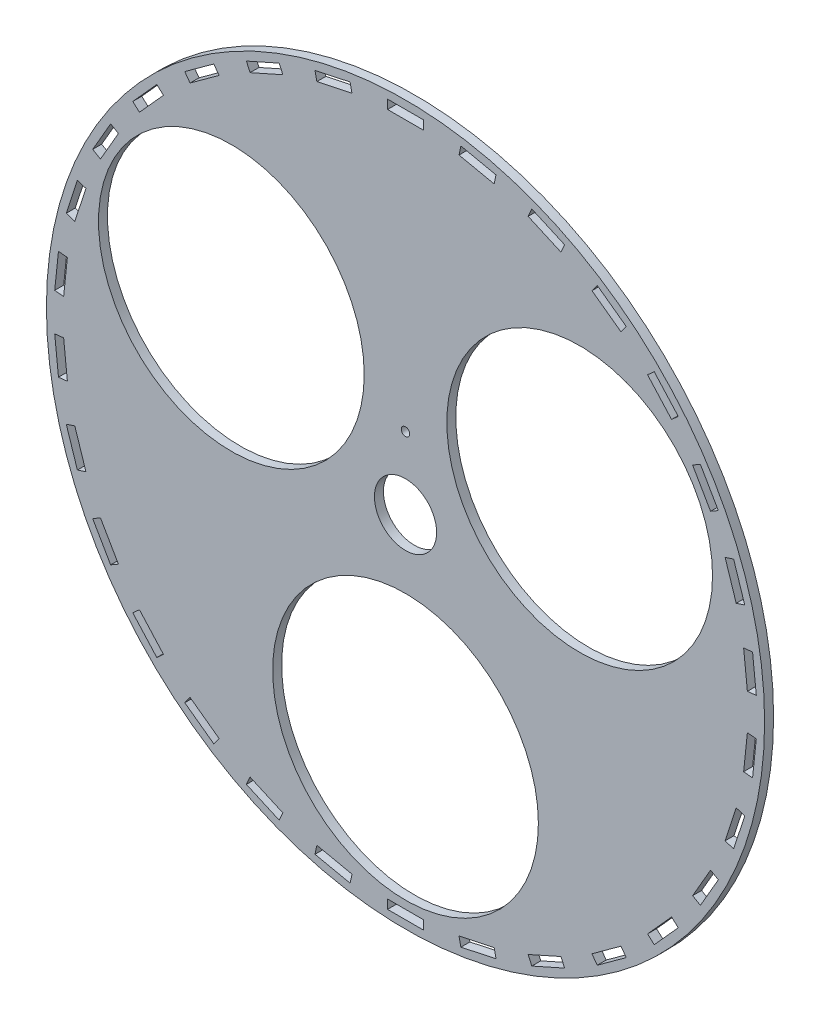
SolidWorks part; units mm, degrees
ref_plane "Front Plane" through (0, 0, 0) normal (0, 0, 1) x (1, 0, 0)
ref_plane "Top Plane" through (0, 0, 0) normal (0, 1, 0) x (1, 0, 0)
ref_plane "Right Plane" through (0, 0, 0) normal (1, 0, 0) x (0, 0, -1)
sketch "Sketch1" plane through (0, 0, 0) normal (0, 0, 1) x (1, 0, 0)
  line L0 (-31.3486, -116.9417) -> (-18.9261, -119.5822)
  line L1 (-6.35, -120.904) -> (6.35, -120.904)
  line L2 (-6.35, -120.904) -> (-6.35, -124.079)
  line L3 (-6.35, -124.079) -> (6.35, -124.079)
  line L4 (6.35, -120.904) -> (6.35, -124.079)
  line L5 (-31.3486, -116.9417) -> (-32.0087, -120.0473)
  line L6 (-32.0087, -120.0473) -> (-19.5862, -122.6878)
  line L7 (-18.9261, -119.5822) -> (-19.5862, -122.6878)
  line L8 (-54.9771, -107.8685) -> (-43.3751, -113.0341)
  line L9 (-54.9771, -107.8685) -> (-56.2685, -110.769)
  line L10 (-56.2685, -110.769) -> (-44.6665, -115.9346)
  line L11 (-43.3751, -113.0341) -> (-44.6665, -115.9346)
  line L12 (-76.2028, -94.081) -> (-65.9283, -101.5458)
  line L13 (-76.2028, -94.081) -> (-78.0691, -96.6496)
  line L14 (-78.0691, -96.6496) -> (-67.7945, -104.1145)
  line L15 (-65.9283, -101.5458) -> (-67.7945, -104.1145)
  line L16 (-94.0982, -76.1816) -> (-85.6002, -85.6195)
  line L17 (-94.0982, -76.1816) -> (-96.4576, -78.3061)
  line L18 (-96.4576, -78.3061) -> (-87.9597, -87.744)
  line L19 (-85.6002, -85.6195) -> (-87.9597, -87.744)
  line L20 (-107.8809, -54.9527) -> (-101.5309, -65.9513)
  line L21 (-107.8809, -54.9527) -> (-110.6306, -56.5402)
  line L22 (-110.6306, -56.5402) -> (-104.2806, -67.5388)
  line L23 (-101.5309, -65.9513) -> (-104.2806, -67.5388)
  line L24 (-116.9488, -31.3222) -> (-113.0243, -43.4006)
  line L25 (-116.9488, -31.3222) -> (-119.9684, -32.3033)
  line L26 (-119.9684, -32.3033) -> (-116.0439, -44.3817)
  line L27 (-113.0243, -43.4006) -> (-116.0439, -44.3817)
  line L28 (-120.9054, -6.3227) -> (-119.5779, -18.9531)
  line L29 (-120.9054, -6.3227) -> (-124.063, -6.6546)
  line L30 (-124.063, -6.6546) -> (-122.7355, -19.285)
  line L31 (-119.5779, -18.9531) -> (-122.7355, -19.285)
  line L32 (-119.5779, 18.9531) -> (-120.9054, 6.3227)
  line L33 (-119.5779, 18.9531) -> (-122.7355, 19.285)
  line L34 (-122.7355, 19.285) -> (-124.063, 6.6546)
  line L35 (-120.9054, 6.3227) -> (-124.063, 6.6546)
  line L36 (-113.0243, 43.4006) -> (-116.9488, 31.3222)
  line L37 (-113.0243, 43.4006) -> (-116.0439, 44.3817)
  line L38 (-116.0439, 44.3817) -> (-119.9684, 32.3033)
  line L39 (-116.9488, 31.3222) -> (-119.9684, 32.3033)
  line L40 (-101.5309, 65.9513) -> (-107.8809, 54.9527)
  line L41 (-101.5309, 65.9513) -> (-104.2806, 67.5388)
  line L42 (-104.2806, 67.5388) -> (-110.6306, 56.5402)
  line L43 (-107.8809, 54.9527) -> (-110.6306, 56.5402)
  line L44 (-85.6002, 85.6195) -> (-94.0982, 76.1816)
  line L45 (-85.6002, 85.6195) -> (-87.9597, 87.744)
  line L46 (-87.9597, 87.744) -> (-96.4576, 78.3061)
  line L47 (-94.0982, 76.1816) -> (-96.4576, 78.3061)
  line L48 (-65.9283, 101.5458) -> (-76.2028, 94.081)
  line L49 (-65.9283, 101.5458) -> (-67.7945, 104.1145)
  line L50 (-67.7945, 104.1145) -> (-78.0691, 96.6496)
  line L51 (-76.2028, 94.081) -> (-78.0691, 96.6496)
  line L52 (-43.3751, 113.0341) -> (-54.9771, 107.8685)
  line L53 (-43.3751, 113.0341) -> (-44.6665, 115.9346)
  line L54 (-44.6665, 115.9346) -> (-56.2685, 110.769)
  line L55 (-54.9771, 107.8685) -> (-56.2685, 110.769)
  line L56 (-18.9261, 119.5822) -> (-31.3486, 116.9417)
  line L57 (-18.9261, 119.5822) -> (-19.5862, 122.6878)
  line L58 (-19.5862, 122.6878) -> (-32.0087, 120.0473)
  line L59 (-31.3486, 116.9417) -> (-32.0087, 120.0473)
  line L60 (6.35, 120.904) -> (-6.35, 120.904)
  line L61 (6.35, 120.904) -> (6.35, 124.079)
  line L62 (6.35, 124.079) -> (-6.35, 124.079)
  line L63 (-6.35, 120.904) -> (-6.35, 124.079)
  line L64 (31.3486, 116.9417) -> (18.9261, 119.5822)
  line L65 (31.3486, 116.9417) -> (32.0087, 120.0473)
  line L66 (32.0087, 120.0473) -> (19.5862, 122.6878)
  line L67 (18.9261, 119.5822) -> (19.5862, 122.6878)
  line L68 (54.9771, 107.8685) -> (43.3751, 113.0341)
  line L69 (54.9771, 107.8685) -> (56.2685, 110.769)
  line L70 (56.2685, 110.769) -> (44.6665, 115.9346)
  line L71 (43.3751, 113.0341) -> (44.6665, 115.9346)
  line L72 (76.2028, 94.081) -> (65.9283, 101.5458)
  line L73 (76.2028, 94.081) -> (78.0691, 96.6496)
  line L74 (78.0691, 96.6496) -> (67.7945, 104.1145)
  line L75 (65.9283, 101.5458) -> (67.7945, 104.1145)
  line L76 (94.0982, 76.1816) -> (85.6002, 85.6195)
  line L77 (94.0982, 76.1816) -> (96.4576, 78.3061)
  line L78 (96.4576, 78.3061) -> (87.9597, 87.744)
  line L79 (85.6002, 85.6195) -> (87.9597, 87.744)
  line L80 (107.8809, 54.9527) -> (101.5309, 65.9513)
  line L81 (107.8809, 54.9527) -> (110.6306, 56.5402)
  line L82 (110.6306, 56.5402) -> (104.2806, 67.5388)
  line L83 (101.5309, 65.9513) -> (104.2806, 67.5388)
  line L84 (116.9488, 31.3222) -> (113.0243, 43.4006)
  line L85 (116.9488, 31.3222) -> (119.9684, 32.3033)
  line L86 (119.9684, 32.3033) -> (116.0439, 44.3817)
  line L87 (113.0243, 43.4006) -> (116.0439, 44.3817)
  line L88 (120.9054, 6.3227) -> (119.5779, 18.9531)
  line L89 (120.9054, 6.3227) -> (124.063, 6.6546)
  line L90 (124.063, 6.6546) -> (122.7355, 19.285)
  line L91 (119.5779, 18.9531) -> (122.7355, 19.285)
  line L92 (119.5779, -18.9531) -> (120.9054, -6.3227)
  line L93 (119.5779, -18.9531) -> (122.7355, -19.285)
  line L94 (122.7355, -19.285) -> (124.063, -6.6546)
  line L95 (120.9054, -6.3227) -> (124.063, -6.6546)
  line L96 (113.0243, -43.4006) -> (116.9488, -31.3222)
  line L97 (113.0243, -43.4006) -> (116.0439, -44.3817)
  line L98 (116.0439, -44.3817) -> (119.9684, -32.3033)
  line L99 (116.9488, -31.3222) -> (119.9684, -32.3033)
  line L100 (101.5309, -65.9513) -> (107.8809, -54.9527)
  line L101 (101.5309, -65.9513) -> (104.2806, -67.5388)
  line L102 (104.2806, -67.5388) -> (110.6306, -56.5402)
  line L103 (107.8809, -54.9527) -> (110.6306, -56.5402)
  line L104 (85.6002, -85.6195) -> (94.0982, -76.1816)
  line L105 (85.6002, -85.6195) -> (87.9597, -87.744)
  line L106 (87.9597, -87.744) -> (96.4576, -78.3061)
  line L107 (94.0982, -76.1816) -> (96.4576, -78.3061)
  line L108 (65.9283, -101.5458) -> (76.2028, -94.081)
  line L109 (65.9283, -101.5458) -> (67.7945, -104.1145)
  line L110 (67.7945, -104.1145) -> (78.0691, -96.6496)
  line L111 (76.2028, -94.081) -> (78.0691, -96.6496)
  line L112 (43.3751, -113.0341) -> (54.9771, -107.8685)
  line L113 (43.3751, -113.0341) -> (44.6665, -115.9346)
  line L114 (44.6665, -115.9346) -> (56.2685, -110.769)
  line L115 (54.9771, -107.8685) -> (56.2685, -110.769)
  line L116 (18.9261, -119.5822) -> (31.3486, -116.9417)
  line L117 (18.9261, -119.5822) -> (19.5862, -122.6878)
  line L118 (19.5862, -122.6878) -> (32.0087, -120.0473)
  line L119 (31.3486, -116.9417) -> (32.0087, -120.0473)
  circle A0 centre (0, 0) radius 127
  circle A1 centre (0, -71.12) radius 46.99
  circle A2 centre (-61.5917, 35.56) radius 46.99
  circle A3 centre (61.5917, 35.56) radius 46.99
  circle A4 centre (0, 0) radius 11
  circle A5 centre (0, 25.4) radius 1.5
  point P7 (0, -120.904)
  point P128 (0, 0)
  point P134 (0, 0)
  dimension "D1" = 254
  dimension "D7" = 93.98
  dimension "D9" = 22
  dimension "D11" = 3
  dimension "D2" = 120.904
  dimension "D3" = 3.175
  dimension "D4" = 12.7
  dimension "D5" = 30
  dimension "D6" = 71.12
  dimension "D8" = 3
  dimension "D10" = 25.4
extrude "Boss-Extrude1" add sketch "Sketch1" along normal blind 3.175
